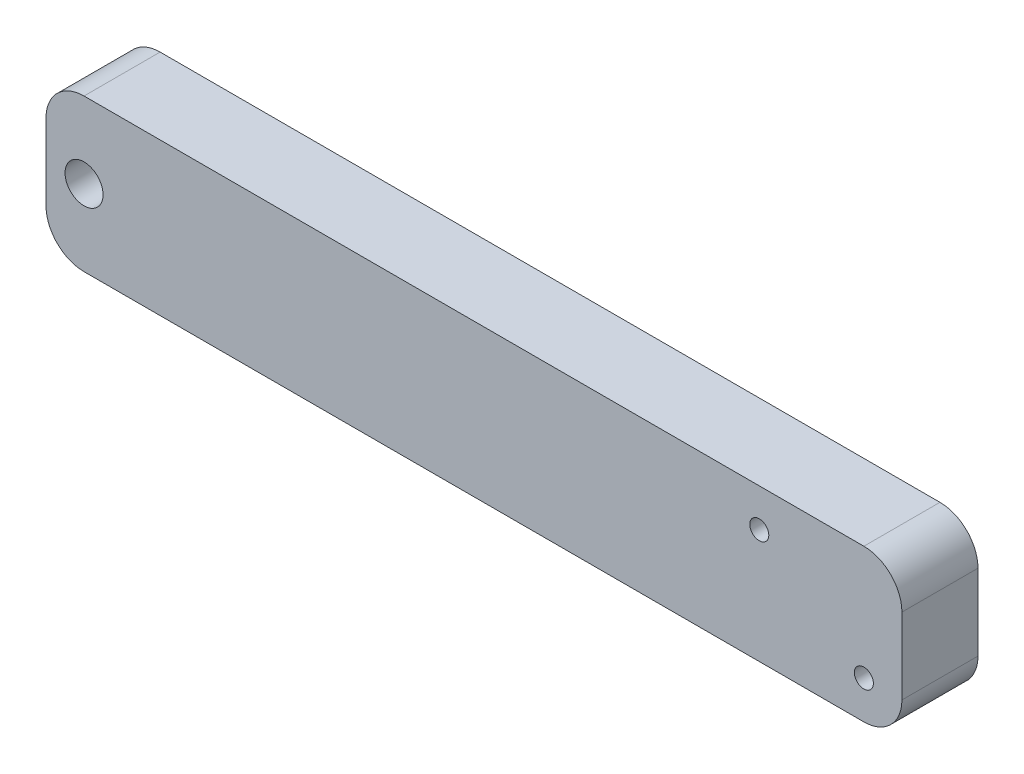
SolidWorks part; units mm, degrees
ref_plane "Plan de face" through (0, 0, 0) normal (0, 0, 1) x (1, 0, 0)
ref_plane "Plan de dessus" through (0, 0, 0) normal (0, 1, 0) x (1, 0, 0)
ref_plane "Plan de droite" through (0, 0, 0) normal (1, 0, 0) x (0, 0, -1)
sketch "Esquisse1" plane through (0, 0, 0) normal (0, 0, 1) x (1, 0, 0)
  line L1 (-54.0428, 29.3343) -> (170.9572, 29.3343)
  line L2 (-54.0428, 29.3343) -> (-54.0428, -10.6657)
  line L3 (-54.0428, -10.6657) -> (170.9572, -10.6657)
  line L4 (170.9572, 29.3343) -> (170.9572, -10.6657)
  dimension "D1" = 225
  dimension "D2" = 40
extrude "Boss.-Extru.1" add sketch "Esquisse1" along normal blind 20
fillet "Congé1" radius 10 4 edges at (-54.0428, -10.6657, 10) (-54.0428, 29.3343, 10) (170.9572, -10.6657, 10) (170.9572, 29.3343, 10)
sketch "Esquisse2" plane through (0, 0, 0) normal (0, 0, -1) x (-1, 0, 0)
  line L0 (-170.9572, -0.6657) -> (-170.9572, 19.3343) construction
  line L1 (-160.9572, 29.3343) -> (44.0428, 29.3343) construction
  line L2 (54.0428, 19.3343) -> (54.0428, -0.6657) construction
  line L3 (44.0428, -10.6657) -> (-160.9572, -10.6657) construction
  circle A0 centre (-160.9572, -0.6657) radius 2.5
  circle A1 centre (-133.4618, 19.3343) radius 2.5
  circle A2 centre (44.0428, 9.3343) radius 5
  dimension "D1" = 10
  dimension "D7" = 5
  dimension "D8" = 5
  dimension "D9" = 10
  dimension "D4" = 10
  dimension "D2" = 34
  dimension "D3" = 10
  dimension "D5" = 20
  dimension "D6" = 10
extrude "Enlèv. mat.-Extru.1" cut sketch "Esquisse2" against normal up to next
